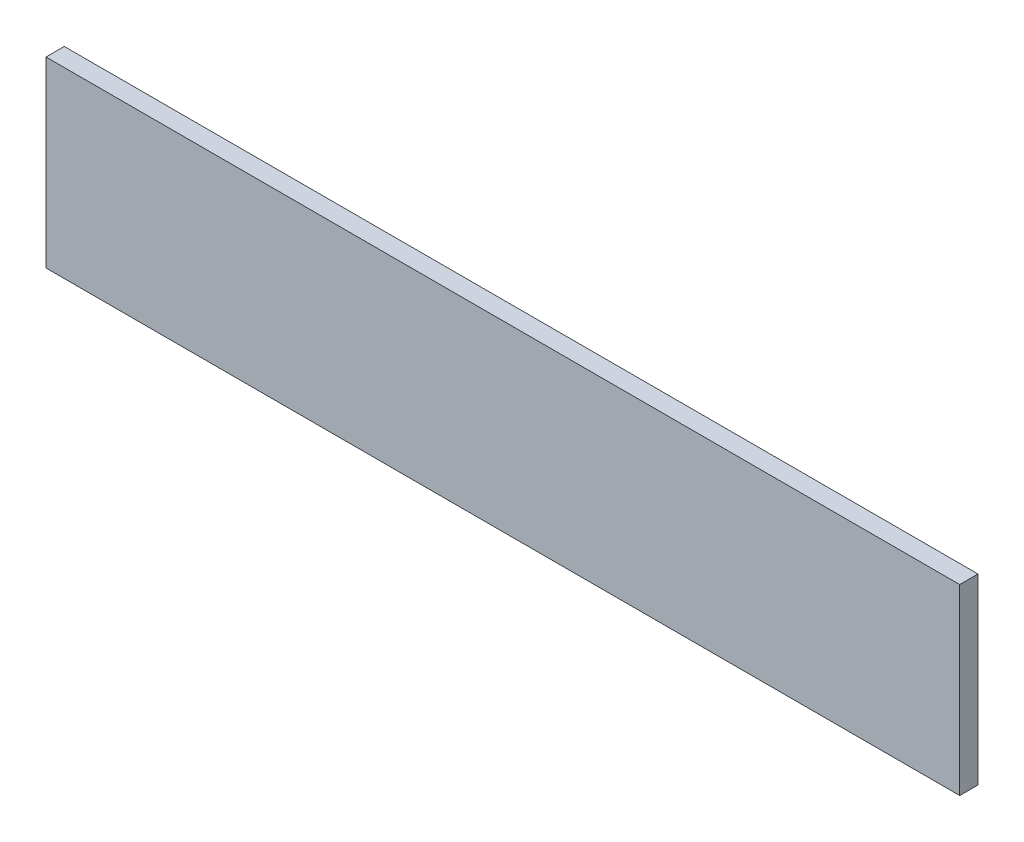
SolidWorks part; units mm, degrees
ref_plane "Plan de face" through (0, 0, 0) normal (0, 0, 1) x (1, 0, 0)
ref_plane "Plan de dessus" through (0, 0, 0) normal (0, 1, 0) x (1, 0, 0)
ref_plane "Plan de droite" through (0, 0, 0) normal (1, 0, 0) x (0, 0, -1)
sketch "Esquisse1" plane through (0, 0, 0) normal (0, 0, 1) x (1, 0, 0)
  line L1 (-0.849, 0) -> (499.151, 0)
  line L2 (-0.849, 0) -> (-0.849, -100)
  line L3 (-0.849, -100) -> (499.151, -100)
  line L4 (499.151, 0) -> (499.151, -100)
  dimension "D1" = 500
  dimension "D2" = 100
extrude "Extrusion1" add sketch "Esquisse1" along normal blind 10
